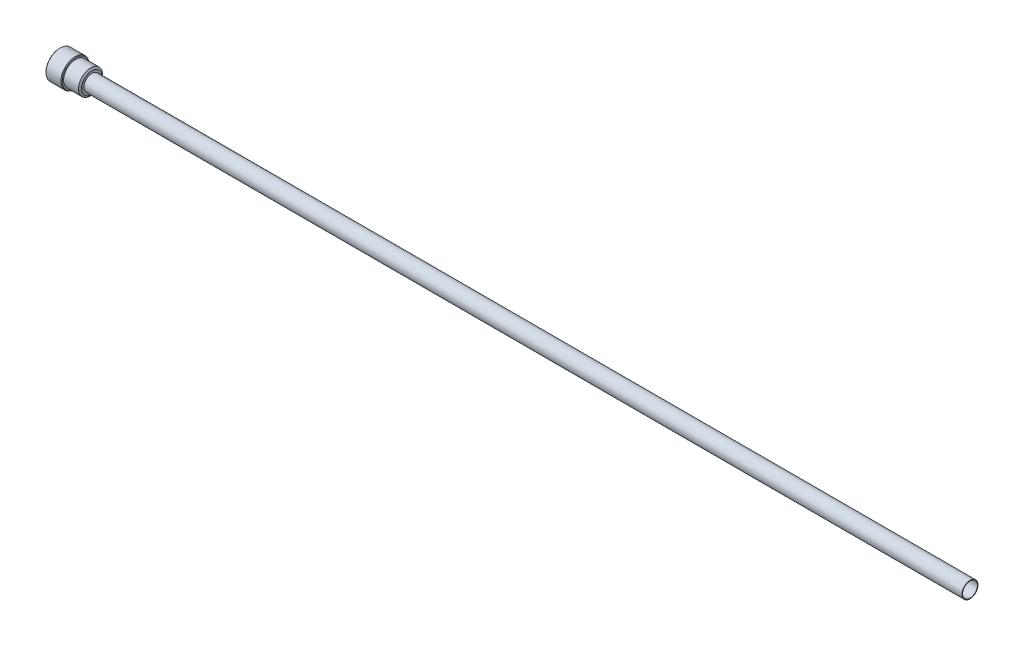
SolidWorks part; units mm, degrees
ref_plane "Front Plane" through (0, 0, 0) normal (0, 0, 1) x (1, 0, 0)
ref_plane "Top Plane" through (0, 0, 0) normal (0, 1, 0) x (1, 0, 0)
ref_plane "Right Plane" through (0, 0, 0) normal (1, 0, 0) x (0, 0, -1)
sketch "Sketch1" plane through (0, 0, 0) normal (0, 0, 1) x (1, 0, 0)
  line L1 (16, 5.035) -> (15.9, 5.035)
  line L2 (8, 6) -> (15.3429, 6)
  line L4 (16, 5.035) -> (16, 3.9751)
  line L5 (16, 3.9751) -> (450, 3.9751)
  line L6 (450, 3.9751) -> (450, 3.6576)
  line L7 (450, 3.6576) -> (0, 3.6576)
  line L8 (0, 3.6576) -> (0, 7)
  line L9 (-22.2122, 0) -> (63.2184, 0) construction
  line L10 (8, 6) -> (8, 7)
  line L11 (15.9, 5.035) -> (15.3429, 6)
  line L12 (8, 7) -> (0, 7)
  dimension "D2" = 8
  dimension "D1" = 12
  dimension "D3" = 16
  dimension "tube ID" = 7.3152
  dimension "D4" = 10.07
  dimension "D5" = 60
  dimension "D6" = 0.1
  dimension "D7" = 7.9502
  dimension "D8" = 450
  dimension "D9" = 14
revolve "Revolve1" add sketch "Sketch1" angle 360 about L9
sketch "Sketch8" plane through (0, 0, 0) normal (0, 0, 1) x (1, 0, 0)
  line L0 (0, 0) -> (-21.6602, 0) construction
  line L1 (0, 0) -> (0, 4)
  line L3 (0, 4) -> (5, 4)
  line L4 (5, 4) -> (7.4034, 0)
  line L5 (7.4034, 0) -> (0, 0)
  dimension "D1" = 59
  dimension "D2" = 8
  dimension "D3" = 5
chamfer "Chamfer3" distance 0.3 angle 45 2 edges at (8, 0, 7) (0, 0, 7)
revolve "Cut-Revolve1" cut sketch "Sketch8" angle 360 about L0
chamfer "Chamfer2" distance 0.6 angle 45 1 edges at (0, 0, -4)
sketch "Sketch7" plane through (0, 0, 0) normal (-1, 0, 0) x (0, 0, 1)
  line L1 (-2.3094, 4) -> (-4.6188, 0)
  line L2 (-4.6188, 0) -> (-2.3094, -4)
  line L3 (-2.3094, -4) -> (2.3094, -4)
  line L4 (2.3094, -4) -> (4.6188, 0)
  line L5 (4.6188, 0) -> (2.3094, 4)
  line L6 (2.3094, 4) -> (-2.3094, 4)
  circle A0 centre (0, 0) radius 4 construction
  circle A1 centre (0, 0) radius 4 construction
extrude "Cut-Extrude1" cut sketch "Sketch7" against normal up to surface (4.6282 mm away)
